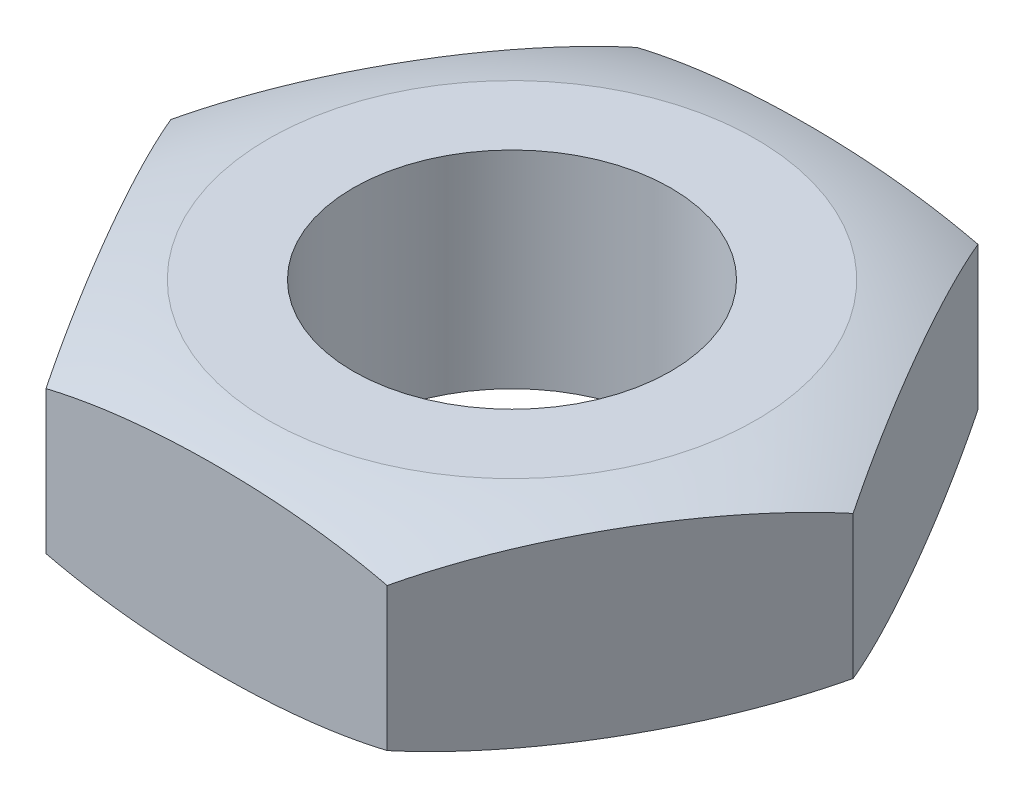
SolidWorks part; units mm, degrees
ref_plane "Front XY" through (0, 0, 0) normal (0, 0, 1) x (1, 0, 0)
ref_plane "Top XZ" through (0, 0, 0) normal (0, 1, 0) x (1, 0, 0)
ref_plane "Right YZ" through (0, 0, 0) normal (1, 0, 0) x (0, 0, -1)
sketch "Sketch1" plane through (0, 0, 0) normal (0, 1, 0) x (1, 0, 0)
  line L1 (36.6617, 0) -> (18.3309, 31.75)
  line L2 (18.3309, 31.75) -> (-18.3309, 31.75)
  line L3 (-18.3309, 31.75) -> (-36.6617, 0)
  line L4 (-36.6617, 0) -> (-18.3309, -31.75)
  line L5 (-18.3309, -31.75) -> (18.3309, -31.75)
  line L6 (18.3309, -31.75) -> (36.6617, 0)
  circle A0 centre (0, 0) radius 31.75 construction
  dimension "D1" = 63.5
extrude "Extrude1" add sketch "Sketch1" along normal mid plane 22.225
hole_wizard "1-1/2-6 Tapped Hole1" positions "Sketch3" profile "Sketch2" tap size "1-1/2-6" standard "Ansi Inch"
sketch "Sketch3" plane through (0, 11.1125, 0) normal (0, 1, 0) x (-1, 0, 0)
  point P0 (0, 0)
sketch "Sketch2" plane through (0, 11.1125, 0) normal (1, 0, 0) x (0, 0, 1)
  line L0 (0, 0) -> (0, 22.225)
  line L1 (0, 22.225) -> (17.0663, 22.225)
  line L2 (17.0663, 22.225) -> (17.0663, 0)
  line L5 (17.0663, 0) -> (0, 0)
  line L11 (0, -6.35) -> (0, 107.95) construction
  dimension "Thru Tap Drill Dia." = 34.1325
  dimension "Thru Tap Drill Depth" = 22.225
sketch "Sketch4" plane through (0, 0, 0) normal (0, 0, 1) x (1, 0, 0)
  line L0 (-20.5253, 11.7957) -> (-20.5253, 33.329)
  line L1 (-20.5253, 33.329) -> (-36.6617, 33.329)
  line L2 (-36.6617, 33.329) -> (-36.6617, 7.6834)
  line L3 (-36.6617, 11.1125) -> (-36.6617, -11.1125) construction
  line L4 (0, 0) -> (0, 34.0311) construction
  arc A0 (-36.6617, 7.6834) -> (-20.5253, 11.7957) centre (-18.2809, -30.7267) cw
revolve "Cut-Revolve1" cut sketch "Sketch4" angle 360 about L4
mirror "Mirror1" about plane through (0, 0, 0) normal (0, 1, 0) of "Cut-Revolve1"
